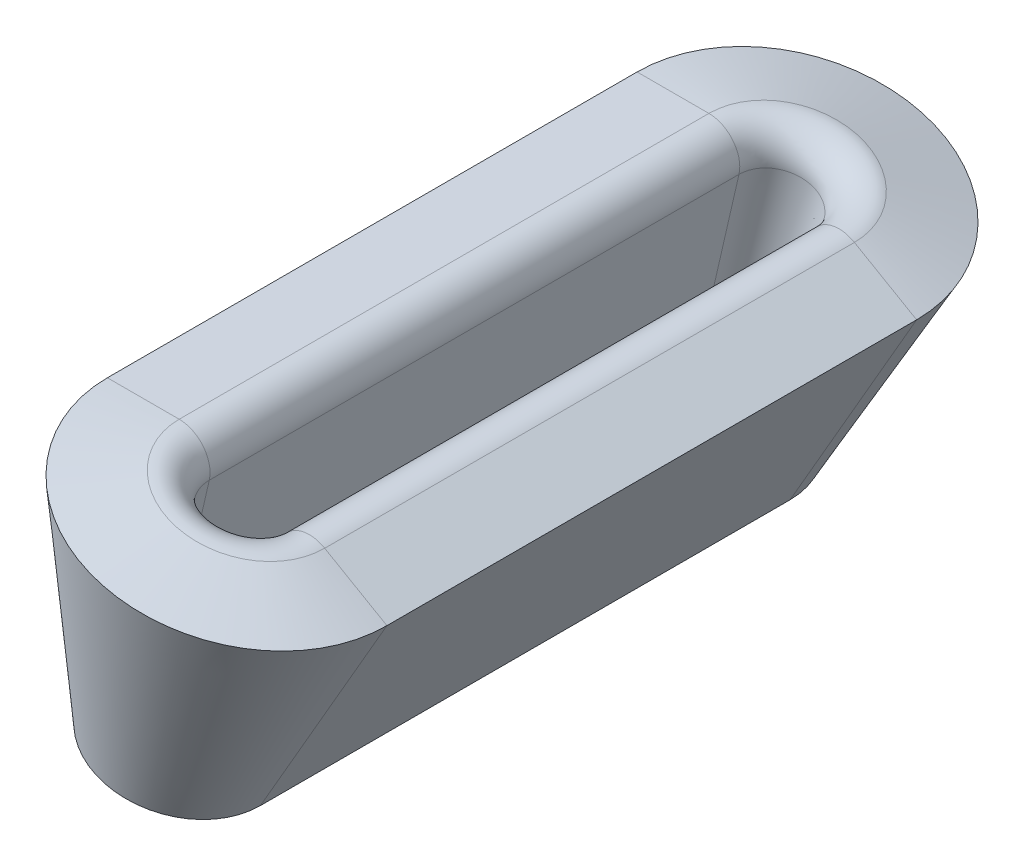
SolidWorks part; units mm, degrees
ref_plane "Přední rovina" through (0, 0, 0) normal (0, 0, 1) x (1, 0, 0)
ref_plane "Horní rovina" through (0, 0, 0) normal (0, 1, 0) x (1, 0, 0)
ref_plane "Pravá rovina" through (0, 0, 0) normal (1, 0, 0) x (0, 0, -1)
sketch "Skica2" plane through (0, 0, 0) normal (0, 0, 1) x (1, 0, 0)
  line L0 (5.1, 30.8734) -> (0, 30.8734)
  line L1 (0, 0) -> (0, 60) construction
  line L514 (5.1, 30.8734) -> (9.9067, 51.8019)
  line L607 (10.75, 55.4734) -> (14.3086, 54.5199) construction
  line L608 (7.7801, 30.1553) -> (5.1, 30.8734) construction
  line L609 (7.7801, 30.1553) -> (14.3086, 54.5199) construction
  line L611 (6.9829, 55.4734) -> (0, 55.4734)
  line L612 (0, 30.8734) -> (0, 55.4734)
  arc A4 (6.9829, 55.4734) -> (9.9067, 51.8019) centre (6.9829, 52.4734) cw
  dimension "D2" = 24.6
  dimension "D3" = 10.75
  dimension "D9" = 3.6841
  dimension "D4" = 5.1
  dimension "D5" = 3
  dimension "D10" = 2.7746
revolve "Rotovat1" add sketch "Skica2" angle 180 about L609
sketch "Skica3" plane through (0, 0, 0) normal (0, 0, 1) x (1, 0, 0)
  line L5 (13.3342, 50.8835) -> (7.7801, 30.1553) construction
  line L12 (16.7616, 49.9651) -> (9.9067, 51.8019) construction
  line L13 (10.4602, 29.4372) -> (5.1, 30.8734) construction
  line L30 (6.9829, 55.4734) -> (0, 55.4734)
  line L31 (0, 55.4734) -> (0, 30.8734)
  line L32 (0, 30.8734) -> (5.1, 30.8734)
  line L33 (5.1, 30.8734) -> (9.9067, 51.8019)
  line L34 (14.8769, 26.8872) -> (10.4602, 29.4372)
  line L35 (10.4602, 29.4372) -> (16.7616, 49.9651)
  line L36 (27.1769, 48.1914) -> (14.8769, 26.8872)
  line L37 (21.1296, 51.6828) -> (27.1769, 48.1914)
  arc A6 (9.9067, 51.8019) -> (6.9829, 55.4734) centre (6.9829, 52.4734) ccw
  arc A7 (16.7616, 49.9651) -> (21.1296, 51.6828) centre (19.6296, 49.0847) cw
extrude "Přidat vysunutím1" add sketch "Skica3" along normal blind 51.5
sketch "Skica4" plane through (0, 0, 51.5) normal (0, 0, 1) x (1, 0, 0)
  line L4 (13.3342, 50.8835) -> (7.7801, 30.1553) construction
  line L9 (6.9829, 55.4734) -> (0, 55.4734)
  line L10 (0, 55.4734) -> (0, 30.8734)
  line L11 (0, 30.8734) -> (5.1, 30.8734)
  line L12 (5.1, 30.8734) -> (9.9067, 51.8019)
  line L13 (16.7616, 49.9651) -> (9.9067, 51.8019) construction
  line L14 (10.4602, 29.4372) -> (5.1, 30.8734) construction
  arc A1 (9.9067, 51.8019) -> (6.9829, 55.4734) centre (6.9829, 52.4734) ccw
revolve "Rotovat2" add sketch "Skica4" angle 180 about L4
